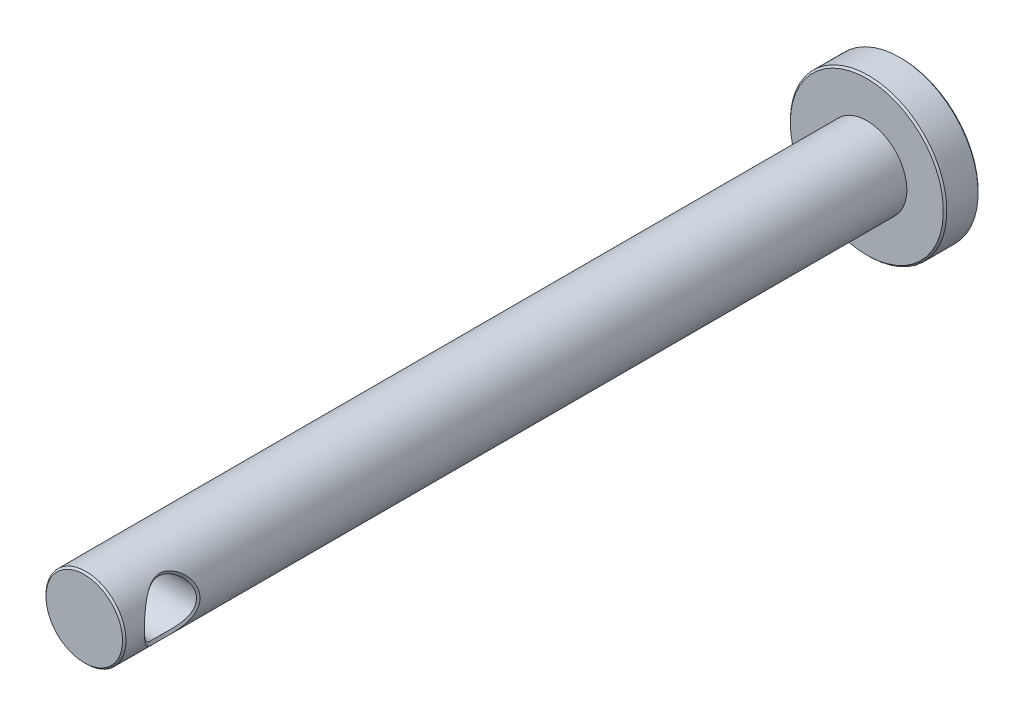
SolidWorks part; units mm, degrees
ref_plane "Plan de face" through (0, 0, 0) normal (0, 0, 1) x (1, 0, 0)
ref_plane "Plan de dessus" through (0, 0, 0) normal (0, 1, 0) x (1, 0, 0)
ref_plane "Plan de droite" through (0, 0, 0) normal (1, 0, 0) x (0, 0, -1)
sketch "Esquisse1" plane through (0, 0, 0) normal (0, 0, 1) x (1, 0, 0)
  circle A0 centre (0, 0) radius 23
  dimension "D1" = 46
extrude "Extrusion1" add sketch "Esquisse1" along normal blind 450
sketch "Esquisse2" plane through (0, 0, 0) normal (1, 0, 0) x (0, 0, -1)
  line L0 (-439.5673, 0) -> (-383.2523, 0) construction
  circle A0 centre (-422.4589, 0) radius 15
  dimension "D1" = 30
extrude "Enlèv. mat.-Extru.1" cut sketch "Esquisse2" against normal mid plane 450
chamfer "Chanfrein1" distance 1 angle 45 3 edges at (-22.8796, 2.3499, 407.6441) (22.8796, 2.3499, 437.2737) (23, 0, 450)
sketch "Esquisse3" plane through (0, 0, 0) normal (0, 0, -1) x (-1, 0, 0)
  circle A0 centre (0, 0) radius 45
  dimension "D1" = 90
extrude "Extrusion2" add sketch "Esquisse3" along normal blind 20
chamfer "Chanfrein2" distance 1 angle 45 2 edges at (-45, 0, 0) (-45, 0, -20)
